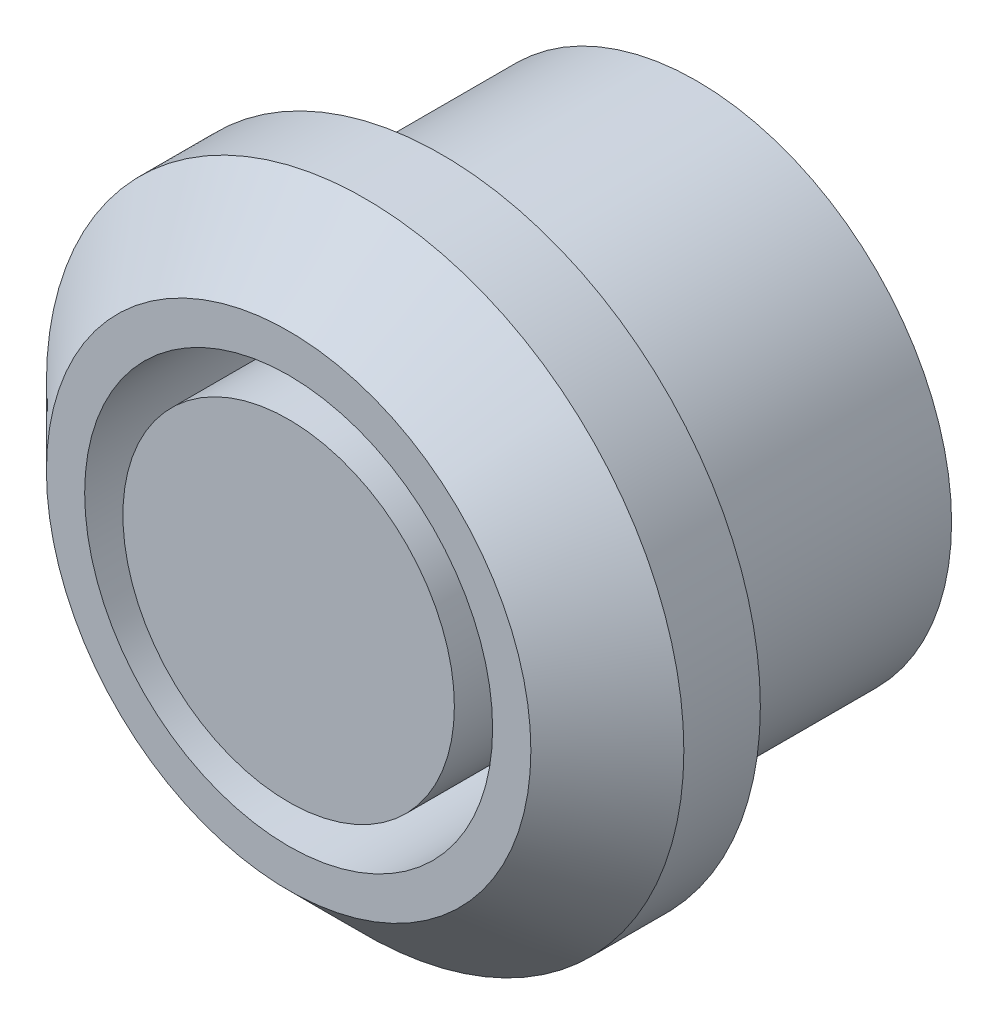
SolidWorks part; units mm, degrees
ref_plane "Plan1" through (0, 0, 0) normal (0, 0, 1) x (1, 0, 0)
ref_plane "Plan2" through (0, 0, 0) normal (0, 1, 0) x (1, 0, 0)
ref_plane "Plan3" through (0, 0, 0) normal (1, 0, 0) x (0, 0, -1)
sketch "Esquisse1" plane through (0, 0, 0) normal (0, 0, 1) x (1, 0, 0)
  circle A0 centre (0, 0) radius 12.5
extrude "Base-Extrusion" add sketch "Esquisse1" along normal blind 6
chamfer "Chanfrein1" distance 3 angle 45
sketch "Esquisse2" plane through (0, 0, 0) normal (0, 0, -1) x (-1, 0, 0)
  circle A0 centre (0, 0) radius 10
extrude "Boss.-Extru.1" add sketch "Esquisse2" along normal blind 10
sketch "Esquisse3" plane through (0, 0, 6) normal (0, 0, 1) x (1, 0, 0)
  circle A0 centre (0, 0) radius 8
extrude "Enlèv. mat.-Extru.1" cut sketch "Esquisse3" against normal blind 10
sketch "Esquisse4" plane through (0, 0, -4) normal (0, 0, 1) x (1, 0, 0)
  circle A0 centre (0, 0) radius 6.5
extrude "Boss.-Extru.2" add sketch "Esquisse4" along normal blind 10
